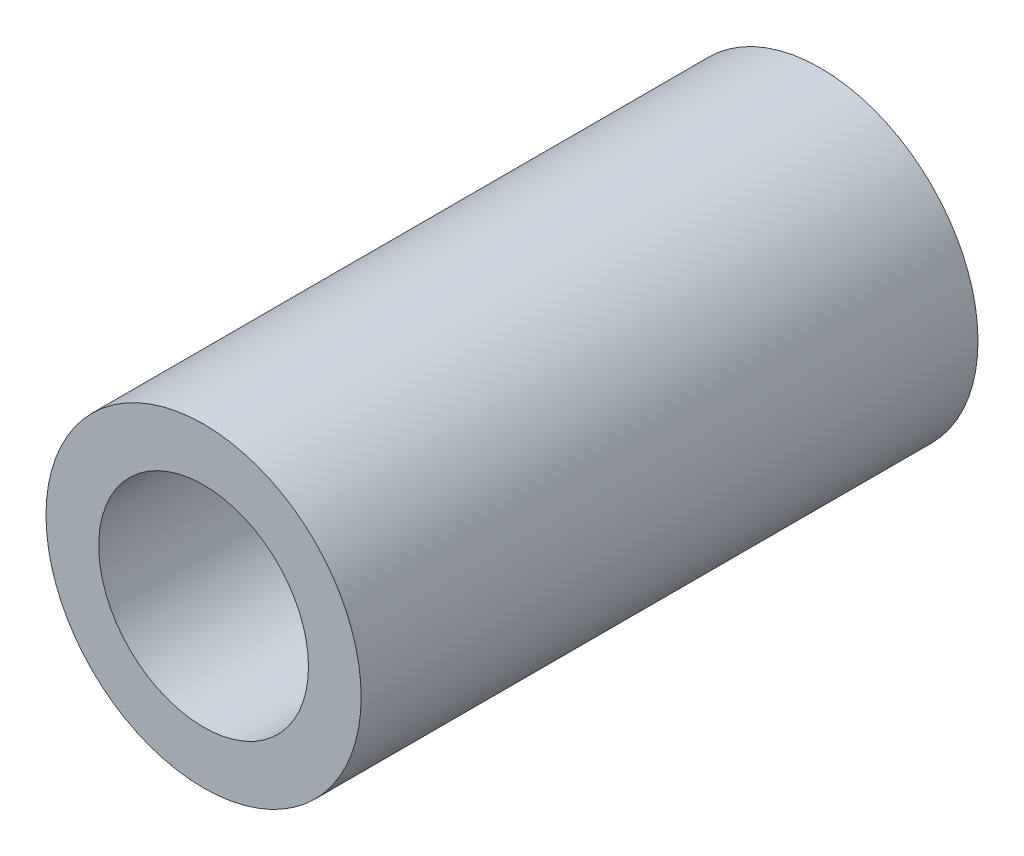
SolidWorks part; units mm, degrees
ref_plane "Front" through (0, 0, 0) normal (0, 0, 1) x (1, 0, 0)
ref_plane "Top" through (0, 0, 0) normal (0, 1, 0) x (1, 0, 0)
ref_plane "Right" through (0, 0, 0) normal (1, 0, 0) x (0, 0, -1)
sketch "Master Sketch" plane through (0, 0, 0) normal (0, 0, 1) x (1, 0, 0)
  circle A0 centre (0, 0) radius 2.9718
  circle A1 centre (0, 0) radius 4.464
  circle A2 centre (0, 0) radius 5.9563
sketch "Sketch2" plane through (0, 0, 0) normal (0, 0, 1) x (1, 0, 0)
  circle A2 centre (0, 0) radius 2.9718 construction
  circle A3 centre (0, 0) radius 4.464 construction
  circle A4 centre (0, 0) radius 2.9718
  circle A5 centre (0, 0) radius 4.464
extrude "Base-Extrude" add sketch "Sketch2" along normal mid plane 17.4752
equation "\"Bushing Diameter@Master Sketch\" = \"Pin Diameter@Master Sketch\" +  (  ( \"Roller Diameter@Master Sketch\" - \"Pin Diameter@Master Sketch\" )  / 2 ) "
